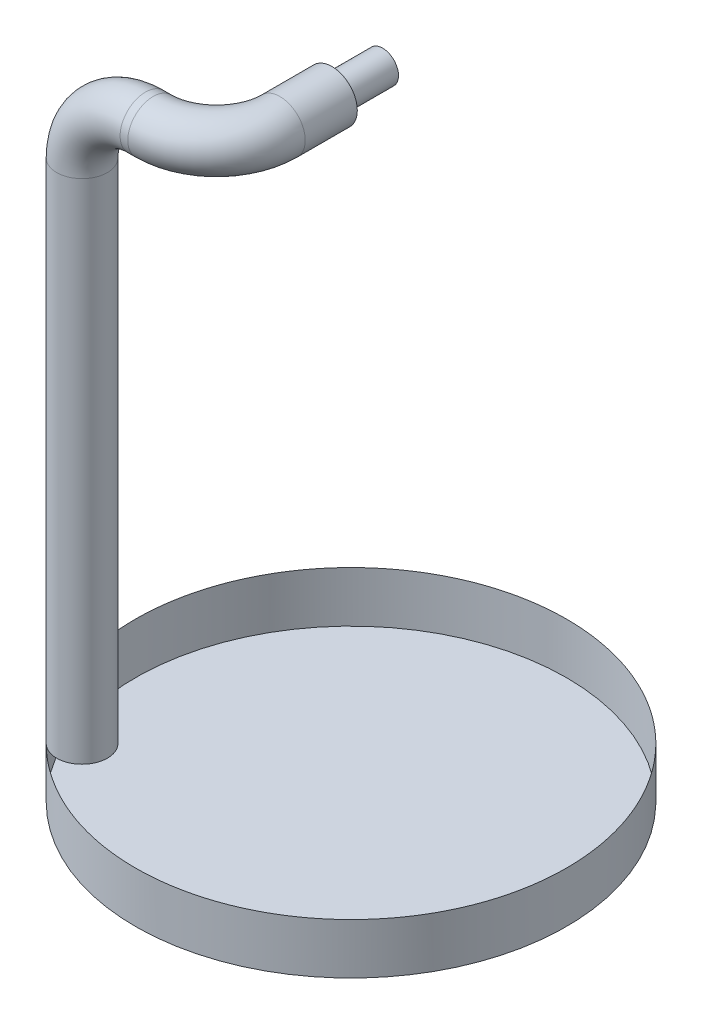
SolidWorks part; units mm, degrees
ref_plane "Plan de face" through (0, 0, 0) normal (0, 0, 1) x (1, 0, 0)
ref_plane "Plan de dessus" through (0, 0, 0) normal (0, 1, 0) x (1, 0, 0)
ref_plane "Plan de droite" through (0, 0, 0) normal (1, 0, 0) x (0, 0, -1)
sketch "Esquisse2" plane through (0, 0, 0) normal (0, 1, 0) x (1, 0, 0)
  line L0 (21.2132, 21.2132) -> (21.2132, -12.7868) construction
  line L1 (21.2132, 21.2132) -> (0, 0) construction
  circle A0 centre (0, 0) radius 4
  circle A1 centre (21.2132, 21.2132) radius 34 construction
  dimension "D1" = 8
  dimension "D2" = 45
  dimension "D3" = 68
sketch3d "Esquisse3D1"
  line L0 (0, 0, 0) -> (0, 80, 0)
  line L1 (10, 90, 0) -> (11.21, 90, 0)
  line L2 (21.21, 90, -10) -> (21.21, 90, -18.21)
  arc A0 (0, 80, 0) -> (10, 90, 0) centre (10, 80, 0) ccw
  arc A1 (11.21, 90, 0) -> (21.21, 90, -10) centre (11.21, 90, -10) ccw
  point P7 (0, 90, 0)
  point P8 (10, 80, -10)
  point P11 (21.21, 90, 0)
  point P12 (11.21, 100, -10)
  dimension "D5" = 10
  dimension "D6" = 10
  dimension "D1" = 90
  dimension "D2" = 21.21
  dimension "D3" = 18.21
  dimension "D4" = 90
sweep "Balayage1" add profiles "Esquisse2" path "Esquisse3D1"
sketch "Esquisse3" plane through (0, 0, -18.21) normal (0, 0, -1) x (-1, 0, 0)
  circle A0 centre (-21.21, 90) radius 2.5
extrude "Extrusion1" add sketch "Esquisse3" along normal blind 8
sketch "Esquisse4" plane through (0, 0, 0) normal (0, -1, 0) x (1, 0, 0)
  line L0 (21.2132, -21.2132) -> (21.2132, 19.5547) construction
  line L1 (21.2132, -21.2132) -> (0, 0) construction
  circle A0 centre (21.2132, -21.2132) radius 34
  dimension "D1" = 30
  dimension "D2" = 68
  dimension "D3" = 45
extrude "Extrusion2" add sketch "Esquisse4" along normal blind 8
